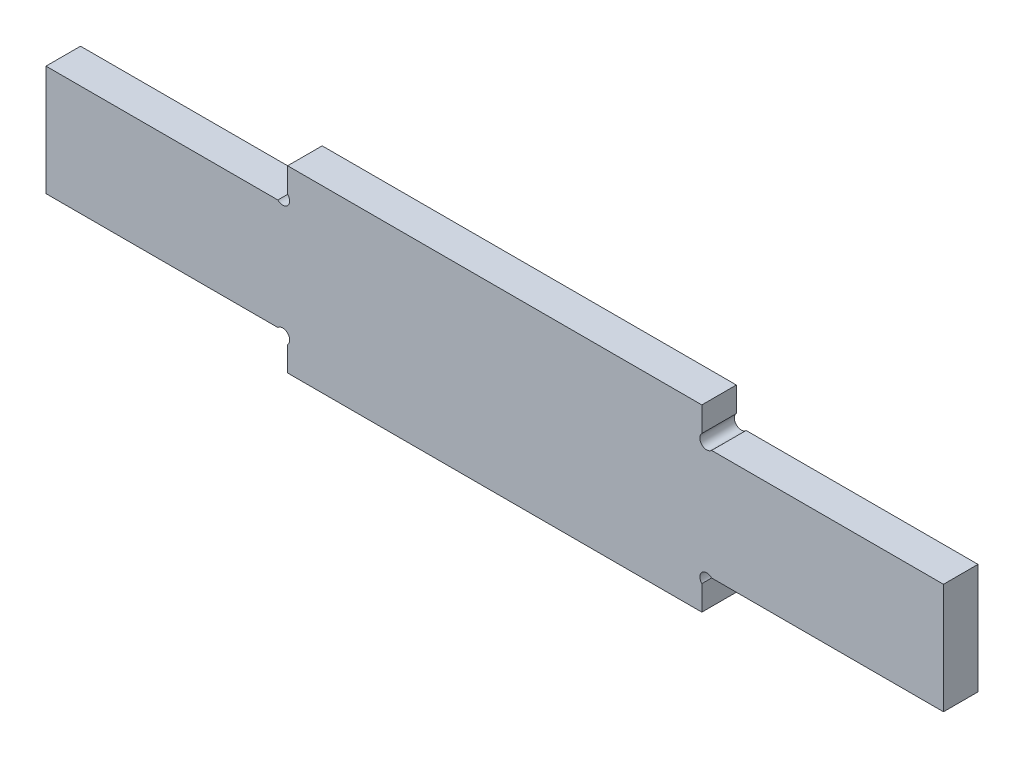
SolidWorks part; units mm, degrees
ref_plane "Plan de face" through (0, 0, 0) normal (0, 0, 1) x (1, 0, 0)
ref_plane "Plan de dessus" through (0, 0, 0) normal (0, 1, 0) x (1, 0, 0)
ref_plane "Plan de droite" through (0, 0, 0) normal (1, 0, 0) x (0, 0, -1)
sketch "Esquisse1" plane through (0, 0, 0) normal (0, 0, 1) x (1, 0, 0)
  line L1 (0, 0) -> (65, 0)
  line L2 (0, 0) -> (0, 26)
  line L3 (0, 26) -> (65, 26)
  line L4 (65, 0) -> (65, 26)
  dimension "D1" = 26
  dimension "D2" = 65
extrude "Boss.-Extru.1" add sketch "Esquisse1" along normal blind 5
sketch "Esquisse2" plane through (0, 0, 5) normal (0, 0, 1) x (1, 0, 0)
  line L1 (0, 26) -> (35, 26)
  line L2 (0, 26) -> (0, 21)
  line L3 (0, 21) -> (35, 21)
  line L4 (35, 26) -> (35, 21)
  line L5 (0, 0) -> (35, 0)
  line L6 (0, 0) -> (0, 5)
  line L7 (0, 5) -> (35, 5)
  line L8 (35, 0) -> (35, 5)
  dimension "D1" = 5
  dimension "D2" = 5
  dimension "D3" = 35
  dimension "D4" = 35
extrude "Enlèv. mat.-Extru.1" cut sketch "Esquisse2" against normal up to next
sketch "Esquisse3" plane through (0, 0, 5) normal (0, 0, 1) x (1, 0, 0)
  line L0 (35, 21) -> (23.0687, 32.9313) construction
  line L1 (35, 5) -> (25.3186, -4.6814) construction
  line L2 (0, 21) -> (35, 21) construction
  line L3 (35, 5) -> (0, 5) construction
  circle A0 centre (34.2929, 21.7071) radius 1
  circle A1 centre (34.2929, 4.2929) radius 1
  dimension "D3" = 2
  dimension "D4" = 2
  dimension "D1" = 45
  dimension "D2" = 45
extrude "Enlèv. mat.-Extru.2" cut sketch "Esquisse3" against normal up to next
mirror "Symétrie1" about plane through (65, 0, 5) normal (-1, 0, 0) of "Boss.-Extru.1", "Enlèv. mat.-Extru.1", "Enlèv. mat.-Extru.2"
